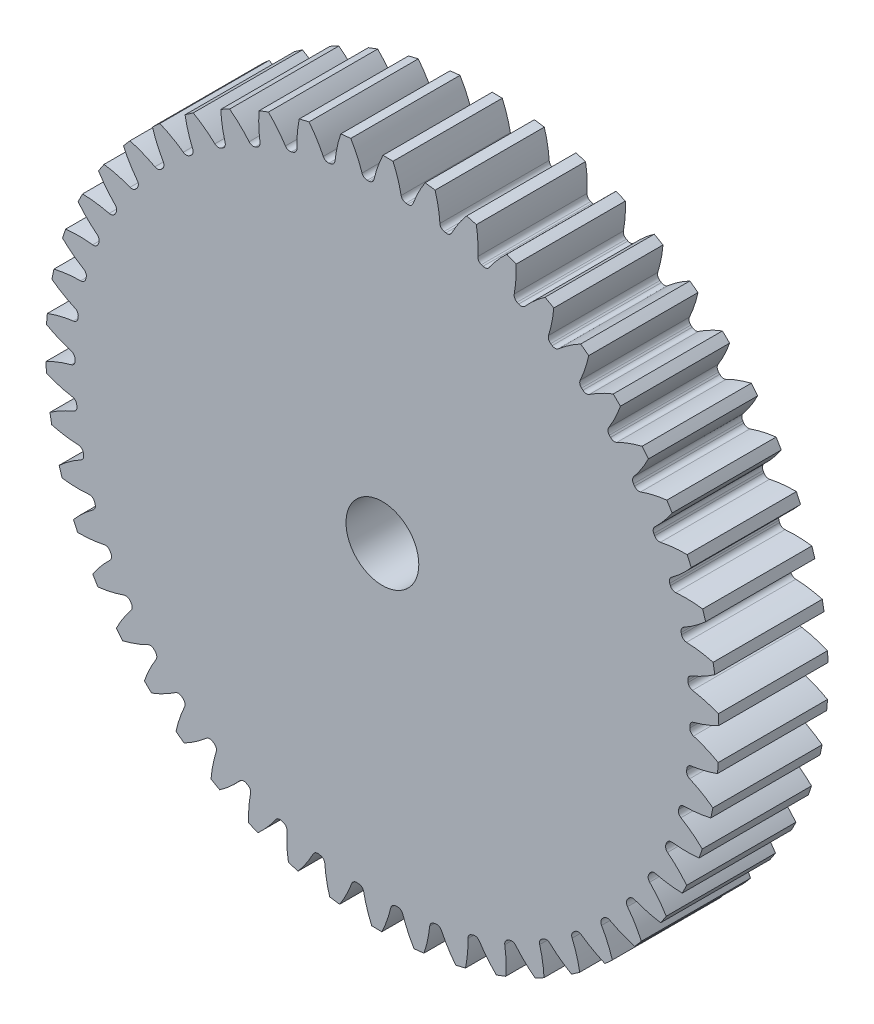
SolidWorks part; units mm, degrees
ref_plane "Front" through (0, 0, 0) normal (0, 0, 1) x (1, 0, 0)
ref_plane "Top" through (0, 0, 0) normal (0, 1, 0) x (1, 0, 0)
ref_plane "Right" through (0, 0, 0) normal (1, 0, 0) x (0, 0, -1)
sketch "Sketch3" plane through (0, 0, 0) normal (0, 0, 1) x (1, 0, 0)
  circle A0 centre (0, 0) radius 293.5111
  dimension "od" = 587.0222
extrude "gearBody" add sketch "Sketch3" along normal blind 95.25
sketch "Sketch2" plane through (0, 0, 0) normal (0, 0, 1) x (1, 0, 0)
  line L0 (0, 0) -> (245.0148, 101.4885) construction
  line L1 (293.0402, -19.018) -> (0, 0) construction
  line L2 (0, 0) -> (36.3143, 0) construction
  line L3 (282.192, 4.1307) -> (281.8978, -13.5291) construction
  line L5 (282.0449, -4.6992) -> (0, 0) construction
  line L7 (0, 0) -> (265.2021, 0) construction
  arc A0 (265.2011, -0.7524) -> (265.0789, -8.0827) centre (0, 0) ccw construction
  arc A1 (293.3678, 9.1701) -> (292.8995, -18.9381) centre (0, 0) ccw construction
  arc A2 (282.192, 4.1307) -> (281.8978, -13.5291) centre (0, 0) ccw construction
  arc A3 (268.0597, -5.2509) -> (268.0858, -3.6819) centre (0, 0) ccw
  arc A4 (293.0402, -19.018) -> (271.3378, -9.7431) centre (241.4979, -109.5943) ccw
  arc A5 (293.0402, -19.018) -> (293.5111, 9.2453) centre (0, 0) ccw
  arc A6 (293.5111, 9.2453) -> (271.5118, 0.6986) centre (245.0148, 101.4885) cw
  arc A7 (268.0858, -3.6819) -> (271.5118, 0.6986) centre (272.68, -3.745) cw
  arc A8 (271.3378, -9.7431) -> (268.0597, -5.2509) centre (272.6534, -5.3409) cw
  point P6 (293.5111, 9.2453)
  point P22 (293.0402, -19.018)
  dimension "baseDia" = 530.4043
  dimension "od" = 587.0222
  dimension "pd" = 564.4444
  dimension "rd" = 536.2222
  dimension "rFillet" = 4.5946
  dimension "pointX" = 293.5111
  dimension "pointY" = 9.2453
  dimension "CTT" = 17.6597
  dimension "flankCenterAngle" = 22.5
extrude "toothCut" cut sketch "Sketch2" along normal through all
pattern_circular "CirPattern1" count 50 over 360 about axis through (0, 0, 0) along (0, 0, 1) of "toothCut"
sketch "hub1Dia" plane through (0, 0, 0) normal (0, 0, -1) x (-1, 0, 0)
  circle A0 centre (0, 0) radius 12.7
  dimension "hub1Dia" = 25.4
sketch "hub2Dia" plane through (0, 0, 95.25) normal (0, 0, 1) x (1, 0, 0)
  circle A0 centre (0, 0) radius 12.7
  dimension "hub2dia" = 25.4
sketch "boreDia" plane through (0, 0, 0) normal (0, 0, 1) x (1, 0, 0)
  circle A0 centre (0, 0) radius 31.75
  dimension "boreDia" = 63.5
extrude "bore" cut sketch "boreDia" against normal mid plane 25400
